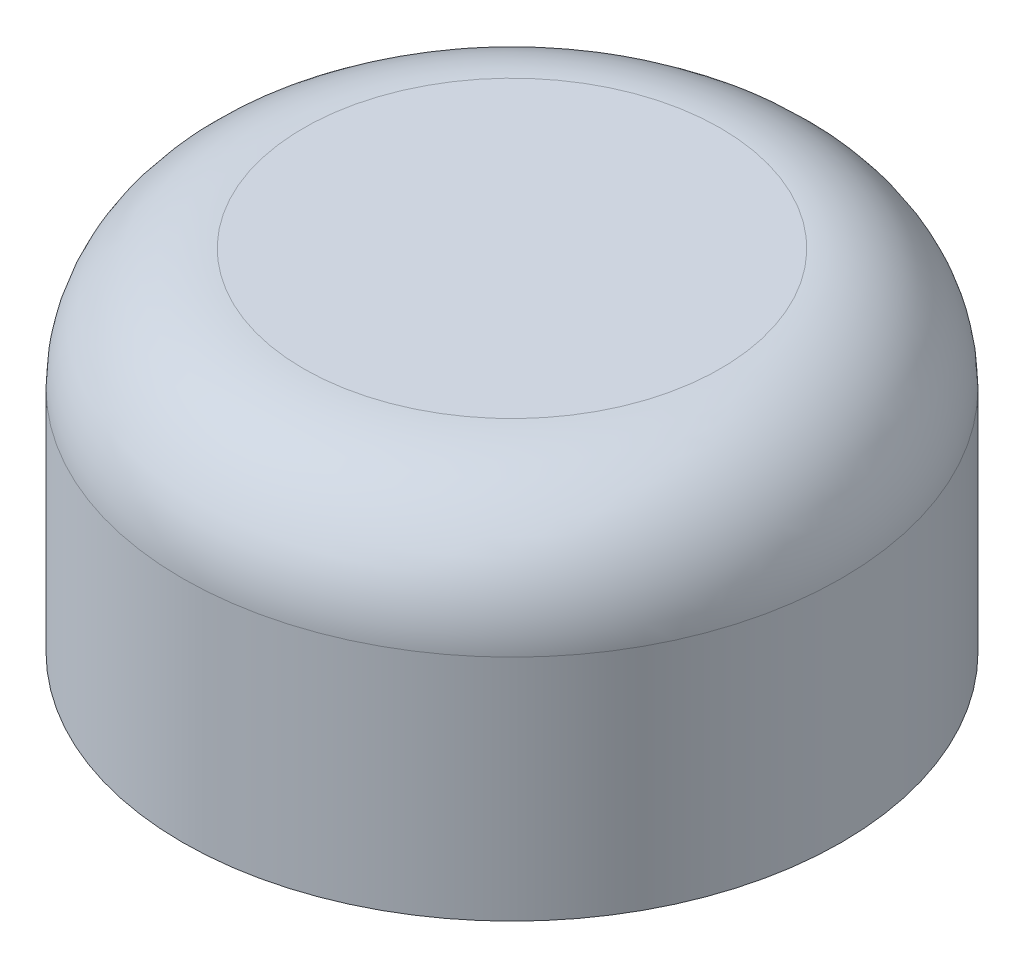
SolidWorks part; units mm, degrees
ref_plane "Front" through (0, 0, 0) normal (0, 0, 1) x (1, 0, 0)
ref_plane "Top" through (0, 0, 0) normal (0, 1, 0) x (1, 0, 0)
ref_plane "Right" through (0, 0, 0) normal (1, 0, 0) x (0, 0, -1)
sketch "Sketch1" plane through (0, 0, 0) normal (0, 0, 1) x (1, 0, 0)
  line L0 (0, 0) -> (0, 28.1396) construction
  line L1 (0, 22.6983) -> (12.446, 22.6983)
  line L2 (12.446, 22.6983) -> (12.446, 9.4903)
  line L3 (12.446, 9.4903) -> (10.16, 9.4903)
  line L5 (10.16, 9.4903) -> (10.16, 10.7603)
  line L6 (10.16, 10.7603) -> (11.684, 10.7603)
  line L7 (11.684, 10.7603) -> (11.684, 21.4283)
  line L8 (11.684, 21.4283) -> (0, 21.4283)
  line L9 (0, 21.4283) -> (0, 22.6983)
  dimension "D1" = 1.27
  dimension "D2" = 12.446
  dimension "D3" = 0.762
  dimension "D4" = 1.27
  dimension "D5" = 2.286
  dimension "D6" = 13.208
revolve "Base-Revolve" add sketch "Sketch1" angle 360 about L0
fillet "Fillet1" radius 3.81 1 edges at (0, 21.4283, -11.684)
fillet "Fillet2" radius 4.572 1 edges at (0, 22.6983, -12.446)
